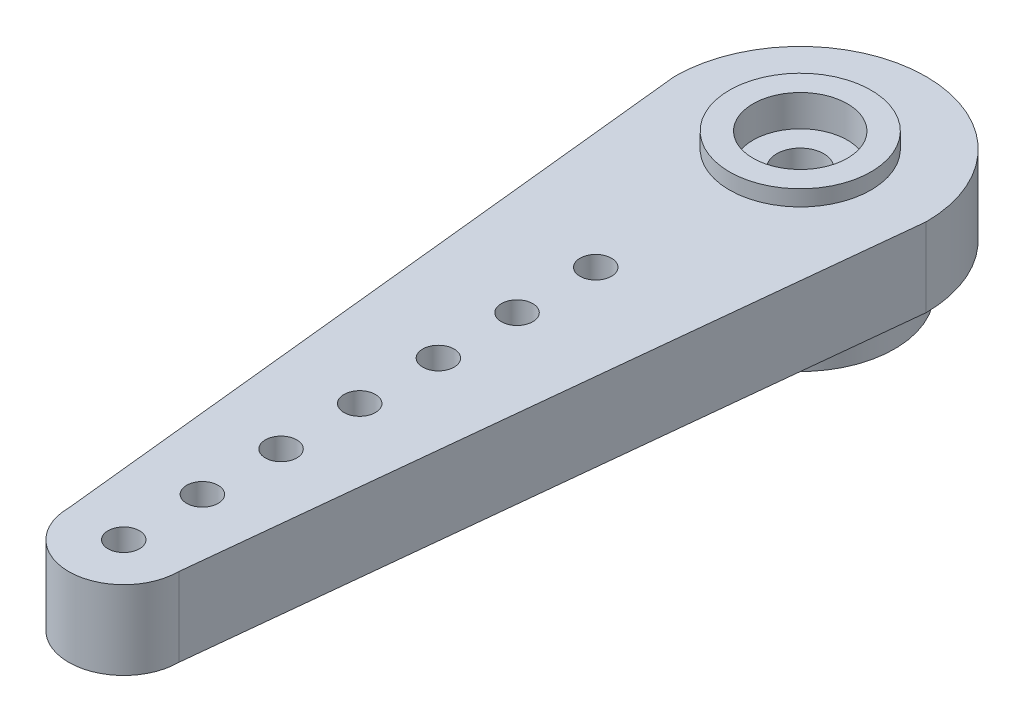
SolidWorks part; units mm, degrees
ref_plane "Front Plane" through (0, 0, 0) normal (0, 0, 1) x (1, 0, 0)
ref_plane "Top Plane" through (0, 0, 0) normal (0, 1, 0) x (1, 0, 0)
ref_plane "Right Plane" through (0, 0, 0) normal (1, 0, 0) x (0, 0, -1)
sketch "Sketch1" plane through (0, 0, 0) normal (0, 1, 0) x (1, 0, 0)
  circle A0 centre (0, 0) radius 6
  dimension "D1" = 12
extrude "Boss-Extrude1" add sketch "Sketch1" along normal blind 3
sketch "Sketch7" plane through (0, 0, 0) normal (0, -1, 0) x (1, 0, 0)
  line L0 (0, 3.75) -> (0, 3.05) construction
  line L1 (0, 3.05) -> (0.7, 3.6841)
  line L2 (0, 3.05) -> (-0.7, 3.6841)
  line L3 (1.2405, 2.7863) -> (2.1379, 3.0809)
  line L4 (1.2405, 2.7863) -> (0.859, 3.6503)
  line L5 (2.2666, 2.0408) -> (3.2062, 1.9449)
  line L6 (2.2666, 2.0408) -> (2.2694, 2.9853)
  line L7 (2.9007, 0.9425) -> (3.7201, 0.4727)
  line L8 (2.9007, 0.9425) -> (3.2875, 1.8042)
  line L9 (3.0333, -0.3188) -> (3.5907, -1.0813)
  line L10 (3.0333, -0.3188) -> (3.7371, 0.3111)
  line L11 (2.6414, -1.525) -> (2.8405, -2.4483)
  line L12 (2.6414, -1.525) -> (3.5405, -1.2358)
  line L13 (1.7927, -2.4675) -> (1.5991, -3.3919)
  line L14 (1.7927, -2.4675) -> (2.7318, -2.569)
  line L15 (0.6341, -2.9834) -> (0.0813, -3.7491)
  line L16 (0.6341, -2.9834) -> (1.4507, -3.458)
  line L17 (-0.6341, -2.9834) -> (-1.4507, -3.458)
  line L18 (-0.6341, -2.9834) -> (-0.0813, -3.7491)
  line L19 (-1.7927, -2.4675) -> (-2.7318, -2.569)
  line L20 (-1.7927, -2.4675) -> (-1.5991, -3.3919)
  line L21 (-2.6414, -1.525) -> (-3.5405, -1.2358)
  line L22 (-2.6414, -1.525) -> (-2.8405, -2.4483)
  line L23 (-3.0333, -0.3188) -> (-3.7371, 0.3111)
  line L24 (-3.0333, -0.3188) -> (-3.5907, -1.0813)
  line L25 (-2.9007, 0.9425) -> (-3.2875, 1.8042)
  line L26 (-2.9007, 0.9425) -> (-3.7201, 0.4727)
  line L27 (-2.2666, 2.0408) -> (-2.2694, 2.9853)
  line L28 (-2.2666, 2.0408) -> (-3.2062, 1.9449)
  line L29 (-1.2405, 2.7863) -> (-0.859, 3.6503)
  line L30 (-1.2405, 2.7863) -> (-2.1379, 3.0809)
  circle A0 centre (0, 0) radius 3.75 construction
  arc A1 (-0.7, 3.6841) -> (0.7, 3.6841) centre (0, 0) cw construction
  arc A2 (0.7, 3.6841) -> (0.9, 3.6404) centre (0, 0) cw
  arc A3 (2.1379, 3.0809) -> (2.3029, 2.9596) centre (0, 0) cw
  arc A4 (3.2062, 1.9449) -> (3.3076, 1.7671) centre (0, 0) cw
  arc A5 (3.7201, 0.4727) -> (3.7403, 0.269) centre (0, 0) cw
  arc A6 (3.5907, -1.0813) -> (3.5264, -1.2756) centre (0, 0) cw
  arc A7 (2.8405, -2.4483) -> (2.7027, -2.5996) centre (0, 0) cw
  arc A8 (1.5991, -3.3919) -> (1.4117, -3.4742) centre (0, 0) cw
  arc A9 (0.0813, -3.7491) -> (-0.1235, -3.748) centre (0, 0) cw
  arc A10 (-1.4507, -3.458) -> (-1.6372, -3.3737) centre (0, 0) cw
  arc A11 (-2.7318, -2.569) -> (-2.8679, -2.4161) centre (0, 0) cw
  arc A12 (-3.5405, -1.2358) -> (-3.6027, -1.0408) centre (0, 0) cw
  arc A13 (-3.7371, 0.3111) -> (-3.7145, 0.5145) centre (0, 0) cw
  arc A14 (-3.2875, 1.8042) -> (-3.1841, 1.9809) centre (0, 0) cw
  arc A15 (-2.2694, 2.9853) -> (-2.1031, 3.1047) centre (0, 0) cw
  arc A16 (-0.859, 3.6503) -> (-0.6585, 3.6917) centre (0, 0) cw
  point P64 (0, 0)
extrude "Cut-Extrude4" cut sketch "Sketch7" against normal through all
sketch "Sketch2" plane through (0, 3, 0) normal (0, 1, 0) x (1, 0, 0)
  line L0 (8, 0) -> (3.5, -43)
  line L1 (-8, 0) -> (-3.5, -43)
  arc A0 (8, 0) -> (-8, 0) centre (0, 0) ccw
  arc A1 (-3.5, -43) -> (3.5, -43) centre (0, -43) ccw
  dimension "D1" = 16
  dimension "D2" = 7
  dimension "D3" = 43
extrude "Boss-Extrude2" add sketch "Sketch2" along normal blind 5
sketch "Sketch3" plane through (0, 8, 0) normal (0, 1, 0) x (1, 0, 0)
  circle A0 centre (0, 0) radius 4.5
  dimension "D1" = 9
extrude "Boss-Extrude3" add sketch "Sketch3" along normal blind 1
sketch "Sketch4" plane through (0, 9, 0) normal (0, 1, 0) x (1, 0, 0)
  circle A0 centre (0, 0) radius 3
  dimension "D1" = 6
extrude "Cut-Extrude1" cut sketch "Sketch4" against normal blind 2
sketch "Sketch5" plane through (0, 7, 0) normal (0, 1, 0) x (1, 0, 0)
  circle A0 centre (0, 0) radius 1.5
  dimension "D1" = 3
extrude "Cut-Extrude2" cut sketch "Sketch5" against normal through all
sketch "Sketch6" plane through (0, 8, 0) normal (0, 1, 0) x (1, 0, 0)
  line L0 (0, -4.5) -> (0, -18.9486) construction
  circle A0 centre (0, -13) radius 1
  circle A1 centre (0, 0) radius 3 construction
  circle A3 centre (0, 0) radius 4.5 construction
  circle A4 centre (0, 0) radius 4.5 construction
  circle A5 centre (0, -18) radius 1
  circle A6 centre (0, -23) radius 1
  circle A7 centre (0, -28) radius 1
  circle A8 centre (0, -33) radius 1
  circle A9 centre (0, -38) radius 1
  circle A10 centre (0, -43) radius 1
  dimension "D1" = 2
  dimension "D2" = 13
  dimension "D3" = 7
extrude "Cut-Extrude3" cut sketch "Sketch6" against normal blind 10
sketch "Sketch8" plane through (0, 3, 0) normal (0, -1, 0) x (1, 0, 0)
  line L30 (-0.859, 3.6503) -> (-1.2405, 2.7863)
  line L31 (-1.2405, 2.7863) -> (-2.1379, 3.0809)
  line L32 (-2.2694, 2.9853) -> (-2.2666, 2.0408)
  line L33 (-2.2666, 2.0408) -> (-3.2062, 1.9449)
  line L34 (-3.2875, 1.8042) -> (-2.9007, 0.9425)
  line L35 (-2.9007, 0.9425) -> (-3.7201, 0.4727)
  line L36 (-3.7371, 0.3111) -> (-3.0333, -0.3188)
  line L37 (-3.0333, -0.3188) -> (-3.5907, -1.0813)
  line L38 (-3.5405, -1.2358) -> (-2.6414, -1.525)
  line L39 (-2.6414, -1.525) -> (-2.8405, -2.4483)
  line L40 (-2.7318, -2.569) -> (-1.7927, -2.4675)
  line L41 (-1.7927, -2.4675) -> (-1.5991, -3.3919)
  line L42 (-1.4507, -3.458) -> (-0.6341, -2.9834)
  line L43 (-0.6341, -2.9834) -> (-0.0813, -3.7491)
  line L44 (0.0813, -3.7491) -> (0.6341, -2.9834)
  line L45 (0.6341, -2.9834) -> (1.4507, -3.458)
  line L46 (1.5991, -3.3919) -> (1.7927, -2.4675)
  line L47 (1.7927, -2.4675) -> (2.7318, -2.569)
  line L48 (2.8405, -2.4483) -> (2.6414, -1.525)
  line L49 (2.6414, -1.525) -> (3.5405, -1.2358)
  line L50 (3.5907, -1.0813) -> (3.0333, -0.3188)
  line L51 (3.0333, -0.3188) -> (3.7371, 0.3111)
  line L52 (3.7201, 0.4727) -> (2.9007, 0.9425)
  line L53 (2.9007, 0.9425) -> (3.2875, 1.8042)
  line L54 (3.2062, 1.9449) -> (2.2666, 2.0408)
  line L55 (2.2666, 2.0408) -> (2.2694, 2.9853)
  line L56 (2.1379, 3.0809) -> (1.2405, 2.7863)
  line L57 (1.2405, 2.7863) -> (0.859, 3.6503)
  line L58 (0.7, 3.6841) -> (0, 3.05)
  line L59 (0, 3.05) -> (-0.7, 3.6841)
  line L60 (-0.859, 3.6503) -> (-1.2405, 2.7863)
  line L61 (-1.2405, 2.7863) -> (-2.1379, 3.0809)
  line L62 (-2.2694, 2.9853) -> (-2.2666, 2.0408)
  line L63 (-2.2666, 2.0408) -> (-3.2062, 1.9449)
  line L64 (-3.2875, 1.8042) -> (-2.9007, 0.9425)
  line L65 (-2.9007, 0.9425) -> (-3.7201, 0.4727)
  line L66 (-3.7371, 0.3111) -> (-3.0333, -0.3188)
  line L67 (-3.0333, -0.3188) -> (-3.5907, -1.0813)
  line L68 (-3.5405, -1.2358) -> (-2.6414, -1.525)
  line L69 (-2.6414, -1.525) -> (-2.8405, -2.4483)
  line L70 (-2.7318, -2.569) -> (-1.7927, -2.4675)
  line L71 (-1.7927, -2.4675) -> (-1.5991, -3.3919)
  line L72 (-1.4507, -3.458) -> (-0.6341, -2.9834)
  line L73 (-0.6341, -2.9834) -> (-0.0813, -3.7491)
  line L74 (0.0813, -3.7491) -> (0.6341, -2.9834)
  line L75 (0.6341, -2.9834) -> (1.4507, -3.458)
  line L76 (1.5991, -3.3919) -> (1.7927, -2.4675)
  line L77 (1.7927, -2.4675) -> (2.7318, -2.569)
  line L78 (2.8405, -2.4483) -> (2.6414, -1.525)
  line L79 (2.6414, -1.525) -> (3.5405, -1.2358)
  line L80 (3.5907, -1.0813) -> (3.0333, -0.3188)
  line L81 (3.0333, -0.3188) -> (3.7371, 0.3111)
  line L82 (3.7201, 0.4727) -> (2.9007, 0.9425)
  line L83 (2.9007, 0.9425) -> (3.2875, 1.8042)
  line L84 (3.2062, 1.9449) -> (2.2666, 2.0408)
  line L85 (2.2666, 2.0408) -> (2.2694, 2.9853)
  line L86 (2.1379, 3.0809) -> (1.2405, 2.7863)
  line L87 (1.2405, 2.7863) -> (0.859, 3.6503)
  line L88 (0.7, 3.6841) -> (0, 3.05)
  line L89 (0, 3.05) -> (-0.7, 3.6841)
  circle A0 centre (0, 0) radius 1.5 construction
  circle A1 centre (0, 0) radius 1.5
  arc A15 (-0.7, 3.6841) -> (-0.859, 3.6503) centre (0, 0) ccw
  arc A16 (-2.1379, 3.0809) -> (-2.2694, 2.9853) centre (0, 0) ccw
  arc A17 (-3.2062, 1.9449) -> (-3.2875, 1.8042) centre (0, 0) ccw
  arc A18 (-3.7201, 0.4727) -> (-3.7371, 0.3111) centre (0, 0) ccw
  arc A19 (-3.5907, -1.0813) -> (-3.5405, -1.2358) centre (0, 0) ccw
  arc A20 (-2.8405, -2.4483) -> (-2.7318, -2.569) centre (0, 0) ccw
  arc A21 (-1.5991, -3.3919) -> (-1.4507, -3.458) centre (0, 0) ccw
  arc A22 (-0.0813, -3.7491) -> (0.0813, -3.7491) centre (0, 0) ccw
  arc A23 (1.4507, -3.458) -> (1.5991, -3.3919) centre (0, 0) ccw
  arc A24 (2.7318, -2.569) -> (2.8405, -2.4483) centre (0, 0) ccw
  arc A25 (3.5405, -1.2358) -> (3.5907, -1.0813) centre (0, 0) ccw
  arc A26 (3.7371, 0.3111) -> (3.7201, 0.4727) centre (0, 0) ccw
  arc A27 (3.2875, 1.8042) -> (3.2062, 1.9449) centre (0, 0) ccw
  arc A28 (2.2694, 2.9853) -> (2.1379, 3.0809) centre (0, 0) ccw
  arc A29 (0.859, 3.6503) -> (0.7, 3.6841) centre (0, 0) ccw
  arc A30 (-0.7, 3.6841) -> (-0.859, 3.6503) centre (0, 0) ccw
  arc A31 (-2.1379, 3.0809) -> (-2.2694, 2.9853) centre (0, 0) ccw
  arc A32 (-3.2062, 1.9449) -> (-3.2875, 1.8042) centre (0, 0) ccw
  arc A33 (-3.7201, 0.4727) -> (-3.7371, 0.3111) centre (0, 0) ccw
  arc A34 (-3.5907, -1.0813) -> (-3.5405, -1.2358) centre (0, 0) ccw
  arc A35 (-2.8405, -2.4483) -> (-2.7318, -2.569) centre (0, 0) ccw
  arc A36 (-1.5991, -3.3919) -> (-1.4507, -3.458) centre (0, 0) ccw
  arc A37 (-0.0813, -3.7491) -> (0.0813, -3.7491) centre (0, 0) ccw
  arc A38 (1.4507, -3.458) -> (1.5991, -3.3919) centre (0, 0) ccw
  arc A39 (2.7318, -2.569) -> (2.8405, -2.4483) centre (0, 0) ccw
  arc A40 (3.5405, -1.2358) -> (3.5907, -1.0813) centre (0, 0) ccw
  arc A41 (3.7371, 0.3111) -> (3.7201, 0.4727) centre (0, 0) ccw
  arc A42 (3.2875, 1.8042) -> (3.2062, 1.9449) centre (0, 0) ccw
  arc A43 (2.2694, 2.9853) -> (2.1379, 3.0809) centre (0, 0) ccw
  arc A44 (0.859, 3.6503) -> (0.7, 3.6841) centre (0, 0) ccw
  dimension "D1" = 0
extrude "Cut-Extrude5" cut sketch "Sketch8" against normal blind 2
